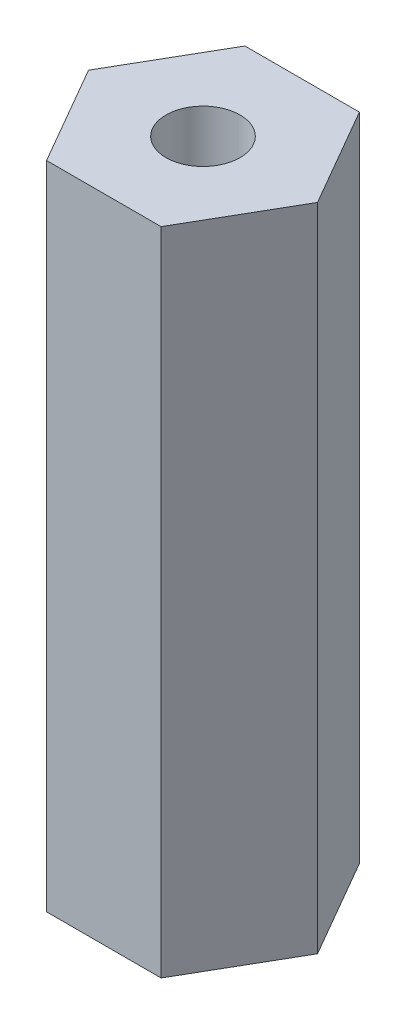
SolidWorks part; units mm, degrees
ref_plane "Front Plane" through (0, 0, 0) normal (0, 0, 1) x (1, 0, 0)
ref_plane "Top Plane" through (0, 0, 0) normal (0, 1, 0) x (1, 0, 0)
ref_plane "Right Plane" through (0, 0, 0) normal (1, 0, 0) x (0, 0, -1)
sketch "Sketch1" plane through (0, 0, 0) normal (0, 1, 0) x (1, 0, 0)
  line L1 (4.3994, 0) -> (2.1997, 3.81)
  line L2 (2.1997, 3.81) -> (-2.1997, 3.81)
  line L3 (-2.1997, 3.81) -> (-4.3994, 0)
  line L4 (-4.3994, 0) -> (-2.1997, -3.81)
  line L5 (-2.1997, -3.81) -> (2.1997, -3.81)
  line L6 (2.1997, -3.81) -> (4.3994, 0)
  circle A0 centre (0, 0) radius 3.81 construction
extrude "Boss-Extrude1" add sketch "Sketch1" along normal blind 25
sketch "Sketch2" plane through (0, 25, 0) normal (0, 1, 0) x (1, 0, 0)
  circle A0 centre (0, 0) radius 1.4224
  dimension "D1" = 2.8448
extrude "Cut-Extrude1" cut sketch "Sketch2" against normal through all
equation "\"D1@Boss-Extrude1\"=25mm"
